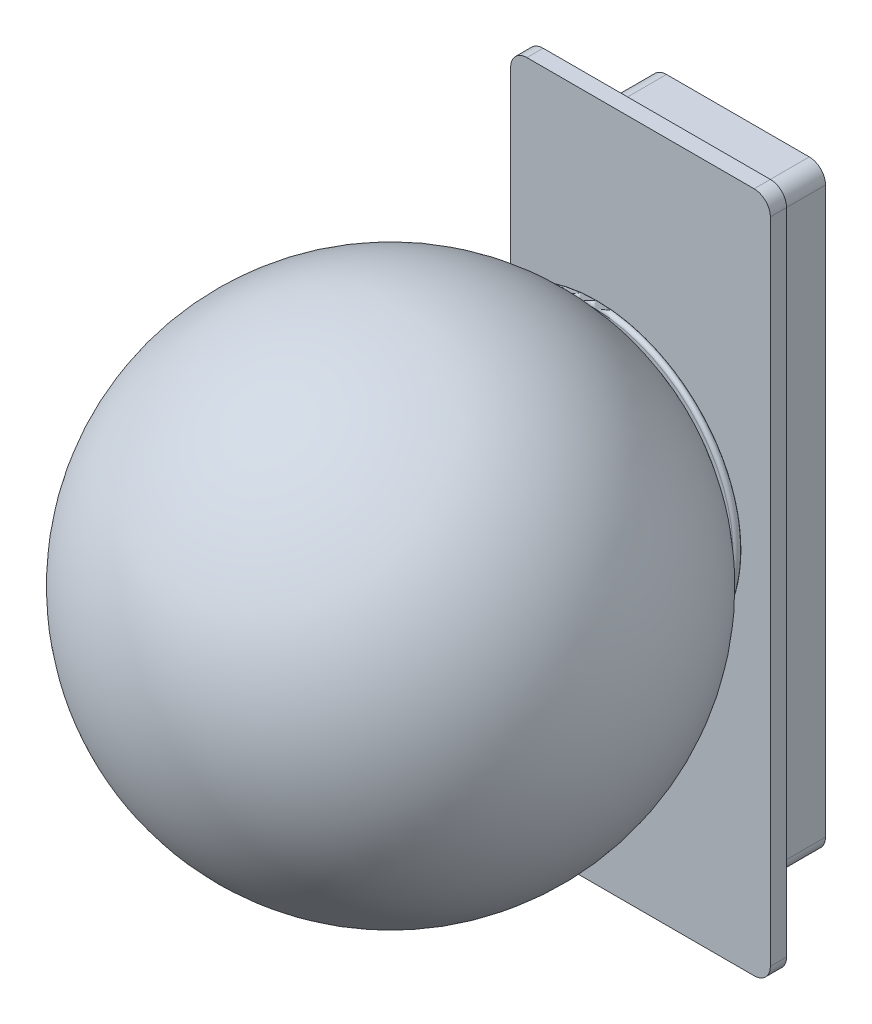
SolidWorks part; units mm, degrees
ref_plane "Alzado" through (0, 0, 0) normal (0, 0, 1) x (1, 0, 0)
ref_plane "Planta" through (0, 0, 0) normal (0, 1, 0) x (1, 0, 0)
ref_plane "Vista lateral" through (0, 0, 0) normal (1, 0, 0) x (0, 0, -1)
sketch "Croquis1" plane through (0, 0, 0) normal (0, 0, 1) x (1, 0, 0)
  line L1 (35, 105) -> (-35, 105)
  line L2 (40, 100) -> (40, -100)
  line L3 (35, -105) -> (-35, -105)
  line L4 (-40, 100) -> (-40, -100)
  line L5 (40, 105) -> (-40, -105) construction
  line L6 (40, -105) -> (-40, 105) construction
  arc A0 (-40, -100) -> (-35, -105) centre (-35, -100) ccw
  arc A1 (35, -105) -> (40, -100) centre (35, -100) ccw
  arc A2 (40, 100) -> (35, 105) centre (35, 100) ccw
  arc A3 (-35, 105) -> (-40, 100) centre (-35, 100) ccw
  point P0 (0, 0)
  dimension "D3" = 5
  dimension "D1" = 80
  dimension "D2" = 210
extrude "Saliente-Extruir1" add sketch "Croquis1" along normal blind 5
sketch "Croquis2" plane through (0, 0, 0) normal (0, 0, -1) x (-1, 0, 0)
  line L8 (27, -92) -> (27, 92)
  line L9 (27, 92) -> (-27, 92)
  line L10 (-27, 92) -> (-27, -92)
  line L11 (-27, -92) -> (27, -92)
  line L12 (27, -87) -> (27, 87)
  line L13 (22, 92) -> (-22, 92)
  line L14 (-27, 87) -> (-27, -87)
  line L15 (-22, -92) -> (22, -92)
  arc A4 (27, -87) -> (22, -92) centre (22, -87) cw
  arc A5 (-22, -92) -> (-27, -87) centre (-22, -87) cw
  arc A6 (27, 87) -> (22, 92) centre (22, 87) ccw
  arc A7 (-22, 92) -> (-27, 87) centre (-22, 87) ccw
  dimension "D2" = 5
  dimension "D1" = 13
extrude "Saliente-Extruir2" add sketch "Croquis2" along normal blind 25
sketch "Croquis3" plane through (0, 0, 0) normal (1, 0, 0) x (0, 0, -1)
  line L0 (-5, 105) -> (-5, 20)
  line L1 (-5, 100) -> (-5, -100) construction
  line L2 (-20.1705, 63.6747) -> (-20.1705, 62.4513)
  line L3 (-5, 20) -> (-157, 20)
  arc A0 (-5, 20) -> (-18.3372, 64.2275) centre (-85, 20) ccw
  arc A1 (-20.1705, 62.4513) -> (-157, 20) centre (-82, 20) ccw
  arc A2 (-20.1705, 63.6747) -> (-18.3372, 64.2275) centre (-19.1705, 63.6747) cw
  dimension "D2" = 160
  dimension "D4" = 1
  dimension "D1" = 85
revolve "Revolución2" add sketch "Croquis3" angle 360 about L3
sketch "Croquis4" plane through (0, 0, -25) normal (0, 0, -1) x (-1, 0, 0)
  line L8 (24, -87) -> (24, 87)
  line L9 (22, 89) -> (-22, 89)
  line L10 (-24, 87) -> (-24, -87)
  line L11 (-22, -89) -> (22, -89)
  line L12 (24, -87) -> (24, 87)
  line L13 (22, 89) -> (-22, 89)
  line L14 (-24, 87) -> (-24, -87)
  line L15 (-22, -89) -> (22, -89)
  arc A8 (22, -89) -> (24, -87) centre (22, -87) ccw
  arc A9 (22, -89) -> (24, -87) centre (22, -87) ccw
  arc A10 (24, 87) -> (22, 89) centre (22, 87) ccw
  arc A11 (24, 87) -> (22, 89) centre (22, 87) ccw
  arc A12 (-22, 89) -> (-24, 87) centre (-22, 87) ccw
  arc A13 (-22, 89) -> (-24, 87) centre (-22, 87) ccw
  arc A14 (-24, -87) -> (-22, -89) centre (-22, -87) ccw
  arc A15 (-24, -87) -> (-22, -89) centre (-22, -87) ccw
  dimension "D1" = 3
extrude "Cortar-Extruir1" cut sketch "Croquis4" against normal blind 15
